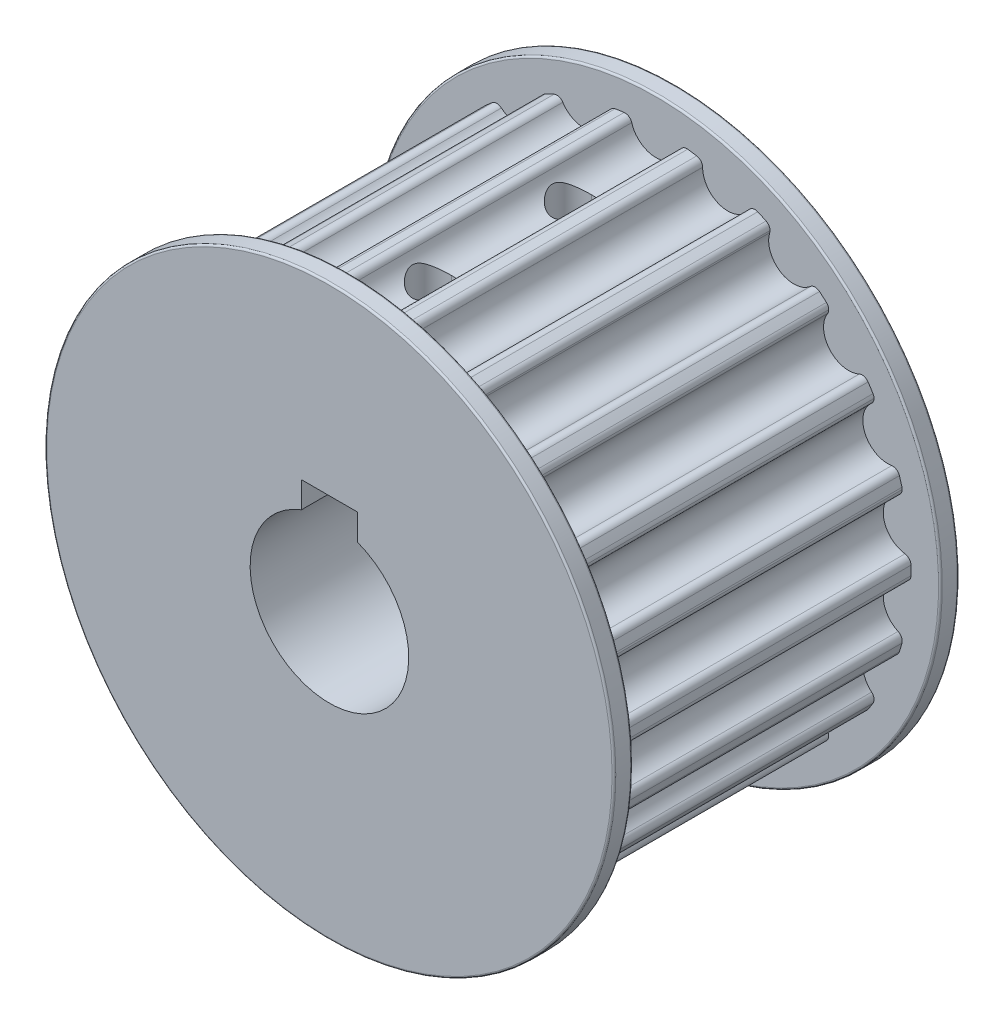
SolidWorks part; units mm, degrees
other "M5 Tapped Hole1[1]"
ref_plane "Front Plane" through (0, 0, 0) normal (0, 0, 1) x (1, 0, 0)
ref_plane "Top Plane" through (0, 0, 0) normal (0, 1, 0) x (1, 0, 0)
ref_plane "Right Plane" through (0, 0, 0) normal (1, 0, 0) x (0, 0, -1)
imported_body "Imported1"
sketch "Sketch2" plane through (0, 0, -2.5) normal (0, 0, -1) x (-1, 0, 0)
  circle A0 centre (0, 0) radius 30
extrude "Cut-Extrude2" cut sketch "Sketch2" against normal blind 1.5
sketch "Sketch3" plane through (0, 0, 37.5) normal (0, 0, 1) x (1, 0, 0)
  circle A0 centre (0, 0) radius 30
extrude "Cut-Extrude3" cut sketch "Sketch3" against normal blind 1.5
sketch "Sketch5" plane through (0, 0, 36) normal (0, 0, 1) x (1, 0, 0)
  line L0 (-3, 10.753) -> (3, 10.753)
  line L1 (3, 10.753) -> (3, 7.953)
  line L2 (-3, 10.753) -> (-3, 7.953)
  circle A0 centre (0, 0) radius 30.5
  arc A1 (-3, 7.953) -> (3, 7.953) centre (0, 0) ccw
extrude "Boss-Extrude1" add sketch "Sketch5" against normal blind 2
sketch "Sketch6" plane through (0, 0, -1) normal (0, 0, -1) x (-1, 0, 0)
  line L0 (3, 10.753) -> (3, 7.953)
  line L1 (3, 10.753) -> (-3, 10.753)
  line L2 (-3, 10.753) -> (-3, 7.953)
  circle A0 centre (0, 0) radius 30.5
  arc A1 (-3, 7.953) -> (3, 7.953) centre (0, 0) ccw
extrude "Boss-Extrude2" add sketch "Sketch6" against normal blind 2
fillet "Fillet1" radius 0.2 4 edges at (-30.5, 0, 1) (-30.5, 0, -1) (30.5, 0, 34) (30.5, 0, 36)
sketch "Sketch7" plane through (0, 0, -1) normal (0, 0, -1) x (-1, 0, 0)
  circle A0 centre (0, 0) radius 13 construction
  text T0 "8M-22-32-D17K6 "
extrude "Cut-Extrude4" cut sketch "Sketch7" against normal blind 0.5
